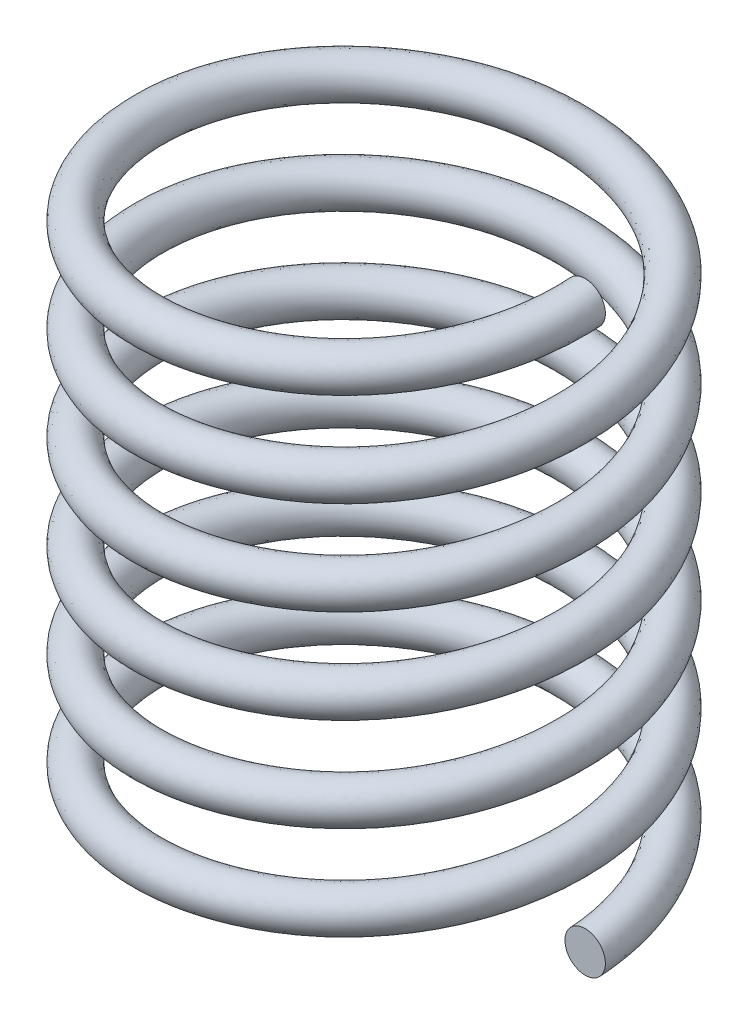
SolidWorks part; units mm, degrees
ref_plane "Front Plane" through (0, 0, 0) normal (0, 0, 1) x (1, 0, 0)
ref_plane "Top Plane" through (0, 0, 0) normal (0, 1, 0) x (1, 0, 0)
ref_plane "Right Plane" through (0, 0, 0) normal (1, 0, 0) x (0, 0, -1)
sketch "Sketch3" plane through (0, 0, 0) normal (0, 0, 1) x (1, 0, 0)
  line L0 (0, 0) -> (0, 12.5283)
  line L1 (-105.8428, 12.5283) -> (-105.0428, 12.5283) construction
sketch "Sketch4" plane through (0, 0, 0) normal (0, 0, 1) x (1, 0, 0)
  line L0 (0, 0) -> (4.7, 0) construction
  circle A0 centre (4.7, 0) radius 0.45
  dimension "D1" = 0.9
  dimension "D2" = 4.7
sweep "Sweep2" add profiles "Sketch4" path "Sketch3" parameters "D4"=2160
